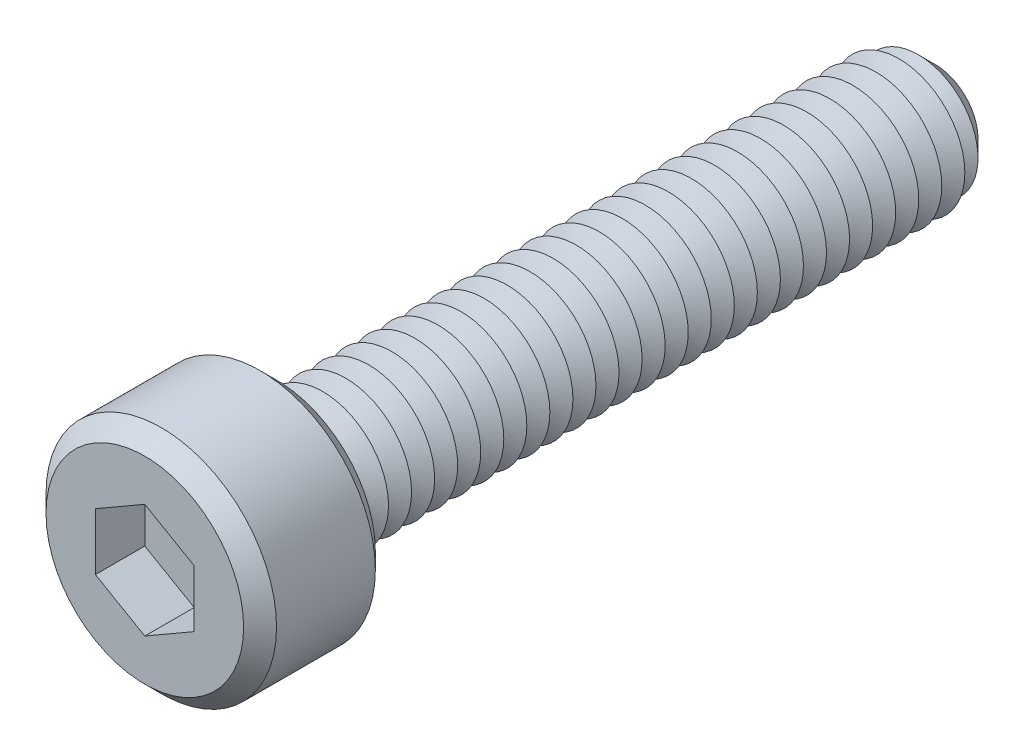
SolidWorks part; units mm, degrees
ref_plane "Front Plane" through (0, 0, 0) normal (0, 0, 1) x (1, 0, 0)
ref_plane "Top Plane" through (0, 0, 0) normal (0, 1, 0) x (1, 0, 0)
ref_plane "Right Plane" through (0, 0, 0) normal (1, 0, 0) x (0, 0, -1)
sketch "Sketch1" plane through (0, 0, 0) normal (0, 0, 1) x (1, 0, 0)
  circle A0 centre (0, 0) radius 3.5
  dimension "D1" = 7
extrude "Boss-Extrude1" add sketch "Sketch1" along normal blind 4
sketch "Sketch2" plane through (0, 0, 0) normal (0, 0, -1) x (-1, 0, 0)
  circle A0 centre (0, 0) radius 2
  dimension "D1" = 4
extrude "Boss-Extrude2" add sketch "Sketch2" along normal blind 20
chamfer "Chamfer1" distance 0.7 angle 45 1 edges at (-2, 0, -20)
sketch "Sketch3" plane through (0, 0, 0) normal (1, 0, 0) x (0, 0, -1)
  line L0 (-2.5121, 0) -> (4.5776, 0) construction
sketch "Sketch4" plane through (0, 0, 0) normal (1, 0, 0) x (0, 0, -1)
  line L0 (0, 2) -> (0.35, 1.3938)
  line L1 (0.35, 1.3938) -> (0.7, 2)
  line L2 (19.3, 2) -> (0, 2) construction
  line L3 (0.7, 2) -> (0, 2)
  dimension "D1" = 0.7
revolve "Cut-Revolve1" cut sketch "Sketch4" angle 360 about L0
pattern_linear "LPattern1" count 28 spacing 0.7 along (0, 0, -1) of "Cut-Revolve1"
sketch "Sketch5" plane through (0, 0, 4) normal (0, 0, 1) x (1, 0, 0)
  line L1 (0, 1.7321) -> (-1.5, 0.866)
  line L2 (-1.5, 0.866) -> (-1.5, -0.866)
  line L3 (-1.5, -0.866) -> (0, -1.7321)
  line L4 (0, -1.7321) -> (1.5, -0.866)
  line L5 (1.5, -0.866) -> (1.5, 0.866)
  line L6 (1.5, 0.866) -> (0, 1.7321)
  circle A0 centre (0, 0) radius 1.5 construction
  dimension "D1" = 3
extrude "Cut-Extrude1" cut sketch "Sketch5" against normal blind 1.5
sketch "Sketch6" plane through (0, 0, 2.5) normal (0, 0, 1) x (1, 0, 0)
  circle A0 centre (0, 0) radius 0.5
  dimension "D1" = 1
extrude "Cut-Extrude2" cut sketch "Sketch6" against normal up to surface (22.5 mm away)
chamfer "Chamfer2" distance 0.5 angle 45 2 edges at (3.5, 0, 0) (3.5, 0, 4)
